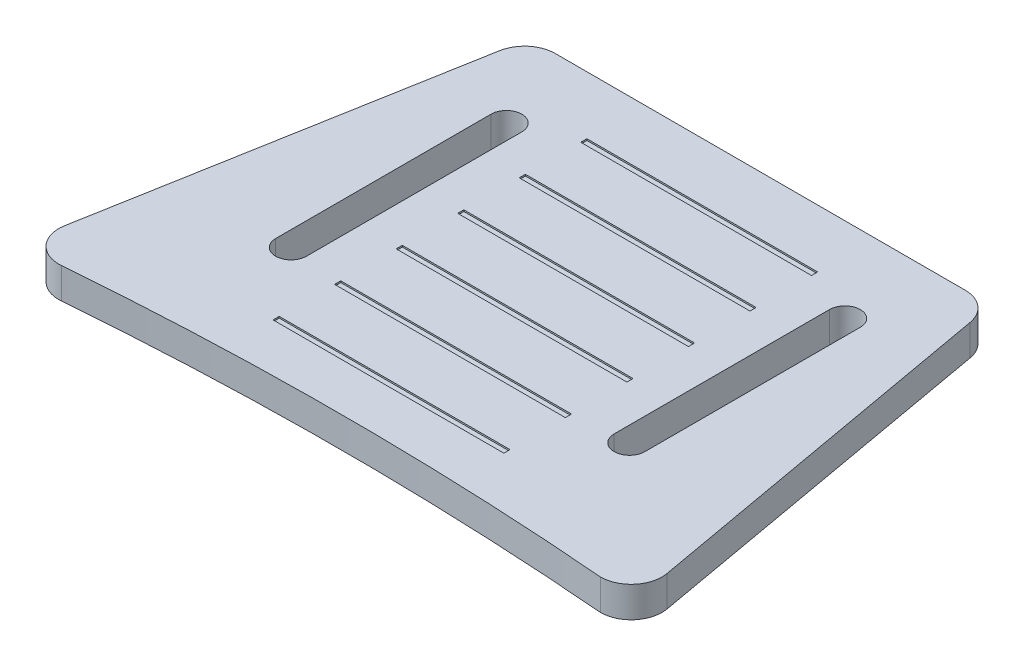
SolidWorks part; units mm, degrees
ref_plane "Plano frontal" through (0, 0, 0) normal (0, 0, 1) x (1, 0, 0)
ref_plane "Plano superior" through (0, 0, 0) normal (0, 1, 0) x (1, 0, 0)
ref_plane "Plano direito" through (0, 0, 0) normal (1, 0, 0) x (0, 0, -1)
sketch "Esboço1" plane through (0, 0, 0) normal (0, 1, 0) x (1, 0, 0)
  line L0 (1.6745, 0) -> (28.3255, 0)
  line L1 (30.2944, -1.6484) -> (34.5801, -25.6484)
  line L3 (-4.5788, -25.6415) -> (-0.2944, -1.6484)
  line L4 (15, -28) -> (15, 0) construction
  line L5 (4, -5.5) -> (4, -19.5) construction
  line L6 (5, -5.5) -> (5, -19.5)
  line L7 (3, -5.5) -> (3, -19.5)
  line L8 (26, -5.5) -> (26, -19.5) construction
  line L9 (25, -5.5) -> (25, -19.5)
  line L10 (27, -5.5) -> (27, -19.5)
  arc A0 (5, -5.5) -> (3, -5.5) centre (4, -5.5) ccw
  arc A1 (3, -19.5) -> (5, -19.5) centre (4, -19.5) ccw
  arc A2 (25, -5.5) -> (27, -5.5) centre (26, -5.5) cw
  arc A3 (27, -19.5) -> (25, -19.5) centre (26, -19.5) cw
  arc A4 (34.5801, -25.6484) -> (32.6112, -28) centre (32.6112, -26) cw
  arc A5 (-2.446, -27.9863) -> (-4.5788, -25.6415) centre (-2.61, -25.9931) cw
  arc A6 (28.3255, 0) -> (30.2944, -1.6484) centre (28.3255, -2) cw
  arc A7 (1.6745, 0) -> (-0.2944, -1.6484) centre (1.6745, -2) ccw
  arc A8 (-2.446, -27.9863) -> (32.6112, -28) centre (15, -240.0623) cw
  point P9 (4, -12.5)
  point P16 (26, -12.5)
  point P23 (35, -28)
  point P26 (-5, -28)
  point P29 (30, 0)
  point P32 (0, 0)
  dimension "D5" = 16
  dimension "D6" = 4.5
  dimension "D8" = 2
  dimension "D1" = 19.5801
  dimension "D2" = 30
  dimension "D3" = 40
  dimension "D4" = 2
  dimension "D7" = 10
  dimension "D9" = 25.6484
  dimension "D10" = 15.2944
extrude "Ressalto-extrusão1" add sketch "Esboço1" along normal blind 2
sketch "Esboço2" plane through (0, 2, 0) normal (0, 1, 0) x (1, 0, 0)
  line L0 (15, 0) -> (15, -27.27) construction
  line L1 (28.3255, 0) -> (1.6745, 0) construction
  line L3 (7.5, -23.7696) -> (22.5, -23.7696)
  line L4 (7.5, -23.7696) -> (7.5, -24.1696)
  line L5 (7.5, -24.1696) -> (22.5, -24.1696)
  line L6 (22.5, -23.7696) -> (22.5, -24.1696)
  line L7 (7.5, -23.7696) -> (22.5, -24.1696) construction
  line L8 (7.5, -24.1696) -> (22.5, -23.7696) construction
  point P7 (15, -23.9696)
  dimension "D1" = 15
  dimension "D2" = 0.4
extrude "Corte-extrusão1" cut sketch "Esboço2" against normal blind 0.1
pattern_linear "Padrão linear1" count 6 spacing 4 along (0, 0, -1) of "Corte-extrusão1"
